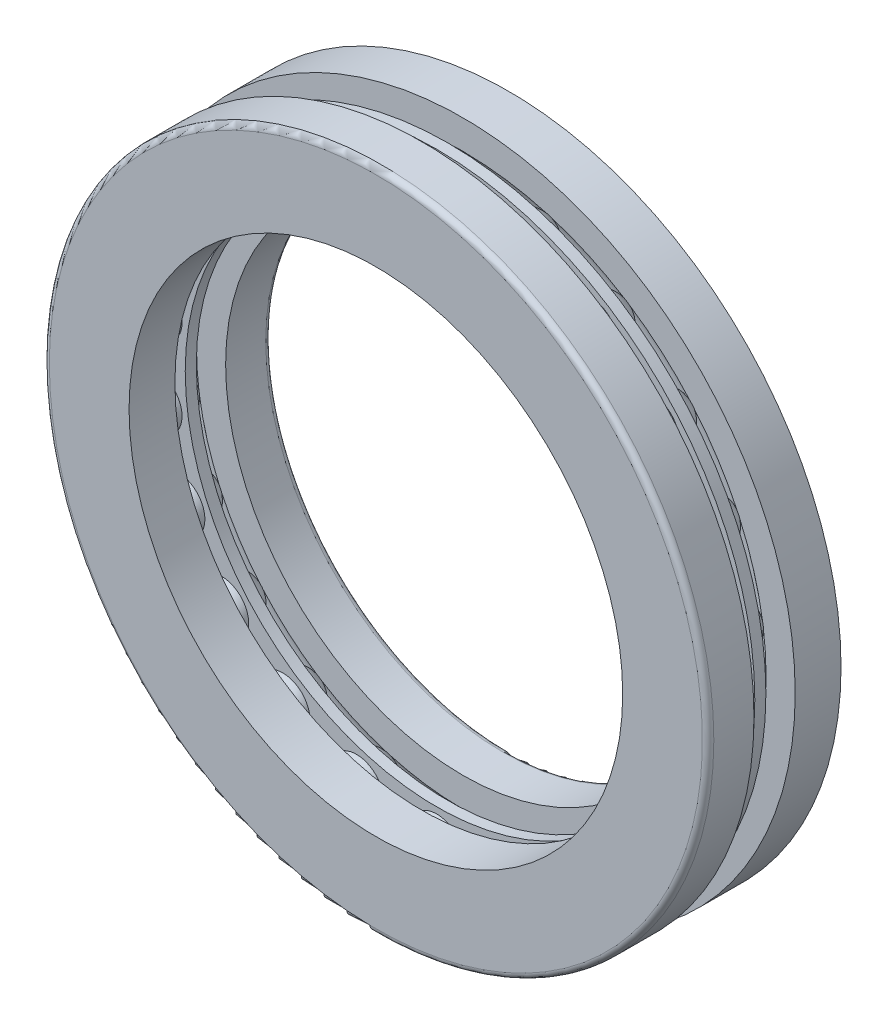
SolidWorks part; units mm, degrees
ref_plane "Front Plane" through (0, 0, 0) normal (0, 0, 1) x (1, 0, 0)
ref_plane "Top Plane" through (0, 0, 0) normal (0, 1, 0) x (1, 0, 0)
ref_plane "Right Plane" through (0, 0, 0) normal (1, 0, 0) x (0, 0, -1)
other "Configuration Table"
sketch "BaseSke" plane through (0, 0, 0) normal (1, 0, 0) x (0, 0, -1)
  line L0 (-22.7078, 0) -> (24.6132, 0) construction
  line L1 (-22.7078, 30) -> (24.6132, 30) construction
  line L2 (0, 129.5214) -> (0, -86.3012) construction
  line L3 (0, 32.9167) -> (0, 27.0833)
  line L6 (-7, 35) -> (-7, 26) construction
  line L8 (7, 35) -> (7, 25) construction
  arc A0 (0, 32.9167) -> (0, 27.0833) centre (0, 30) ccw
revolve "Ball" add sketch "BaseSke" angle 360 about L3
sketch "InnerRaceSke" plane through (0, 0, 0) normal (1, 0, 0) x (0, 0, -1)
  line L0 (2.1724, 28.0689) -> (2.1724, 25)
  line L1 (2.1724, 35) -> (7, 35)
  line L2 (2.1724, 35) -> (2.1724, 31.9311)
  line L3 (2.1724, 25) -> (7, 25)
  line L4 (7, 35) -> (7, 25)
  line L5 (-18.959, 0) -> (19.5136, 0) construction
  arc A0 (2.1724, 28.0689) -> (2.1724, 31.9311) centre (0, 30) ccw
  arc A2 (0, 32.9167) -> (0, 27.0833) centre (0, 30) ccw construction
revolve "InnerRace" add sketch "InnerRaceSke" angle 360 about L5
sketch "OuterRaceSke" plane through (0, 0, 0) normal (1, 0, 0) x (0, 0, -1)
  line L0 (-2.1724, 28.0689) -> (-2.1724, 26)
  line L1 (-7, 35) -> (-2.1724, 35)
  line L2 (-7, 35) -> (-7, 26)
  line L3 (-7, 26) -> (-2.1724, 26)
  line L4 (-2.1724, 35) -> (-2.1724, 31.9311)
  line L5 (-27.1643, 0) -> (37.3715, 0) construction
  arc A0 (-2.1724, 31.9311) -> (-2.1724, 28.0689) centre (0, 30) ccw
  arc A1 (0, 32.9167) -> (0, 27.0833) centre (0, 30) ccw construction
revolve "OuterRace" add sketch "OuterRaceSke" angle 360 about L5
fillet "Fillet1" radius 0.6 2 edges at (35, 0, 7) (25, 0, -7)
pattern_circular "CirPatternBall" count 22 over 360 about axis through (0, 0, 0) along (0, 0, 1) of "Ball"
sketch "CageSke" plane through (0, 0, 0) normal (1, 0, 0) x (0, 0, -1)
  line L0 (0, 59.1614) -> (0, 0) construction
  line L1 (0.5833, 33.5) -> (-0.5833, 33.5)
  line L2 (0.5833, 33.5) -> (0.5833, 26.5)
  line L3 (0.5833, 26.5) -> (-0.5833, 26.5)
  line L4 (-0.5833, 33.5) -> (-0.5833, 26.5)
  line L5 (-23.077, 0) -> (28.998, 0) construction
  circle A0 centre (0, 30) radius 3.5483 construction
  arc A1 (0, 32.9167) -> (0, 27.0833) centre (0, 30) ccw construction
revolve "Cage" add sketch "CageSke" angle 360 about L5
sketch "SimplifiedSke" plane through (0, 0, 0) normal (1, 0, 0) x (0, 0, -1)
  line L0 (-32.3536, 0) -> (41.9236, 0) construction
  circle A0 centre (0, 30) radius 2.9167
  arc A1 (0, 32.9167) -> (0, 27.0833) centre (0, 30) ccw construction
revolve "Simplified" [suppressed] add sketch "SimplifiedSke" angle 360 about L0
equation "\"D2@BaseSke\" = \"Bearing_Thickness@BaseSke\"/2"
equation "\"D1@BaseSke\" =  ( \"Diameter2@BaseSke\" + \"Bearing_Inside_Diameter@BaseSke\" )  / 4"
equation "\"Ball_diameter@BaseSke\" = \"Bearing_Thickness@BaseSke\"  / 2.4"
equation "\"D1@InnerRaceSke\" = \"Ball_diameter@BaseSke\"-0.02"
equation "\"D2@InnerRaceSke\" = \"Bearing_Thickness@BaseSke\"/2.9"
equation "\"D1@OuterRaceSke\" = \"Ball_diameter@BaseSke\"-0.02"
equation "\"D2@OuterRaceSke\" = \"Bearing_Thickness@BaseSke\" / 2.9"
equation "\"D1@CirPatternBall\" =  pi  * \"D1@BaseSke\" * 2 / \"Ball_diameter@BaseSke\"/1.5"
equation "\"D1@CageSke\" = \"Ball_diameter@BaseSke\"/5"
equation "\"D2@CageSke\" = \"Ball_diameter@BaseSke\" * 1.2"
